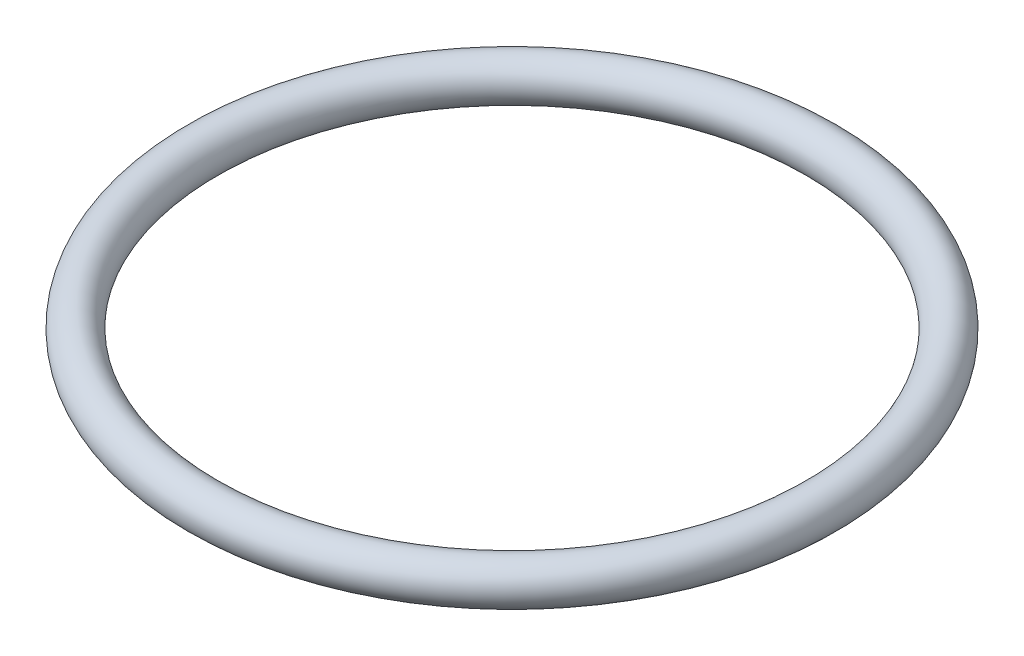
SolidWorks part; units mm, degrees
ref_plane "Front Plane" through (0, 0, 0) normal (0, 0, 1) x (1, 0, 0)
ref_plane "Top Plane" through (0, 0, 0) normal (0, 1, 0) x (1, 0, 0)
ref_plane "Right Plane" through (0, 0, 0) normal (1, 0, 0) x (0, 0, -1)
sketch "Sketch1" plane through (0, 0, 0) normal (0, 0, 1) x (1, 0, 0)
  line L0 (0, 3.7249) -> (0, 0) construction
  line L1 (0, 0) -> (18.0848, 0) construction
  circle A0 centre (19.3929, 0) radius 1.3081
  dimension "D1" = 2.6162
  dimension "D2" = 36.1696
revolve "Revolve1" add sketch "Sketch1" angle 360 about L0
